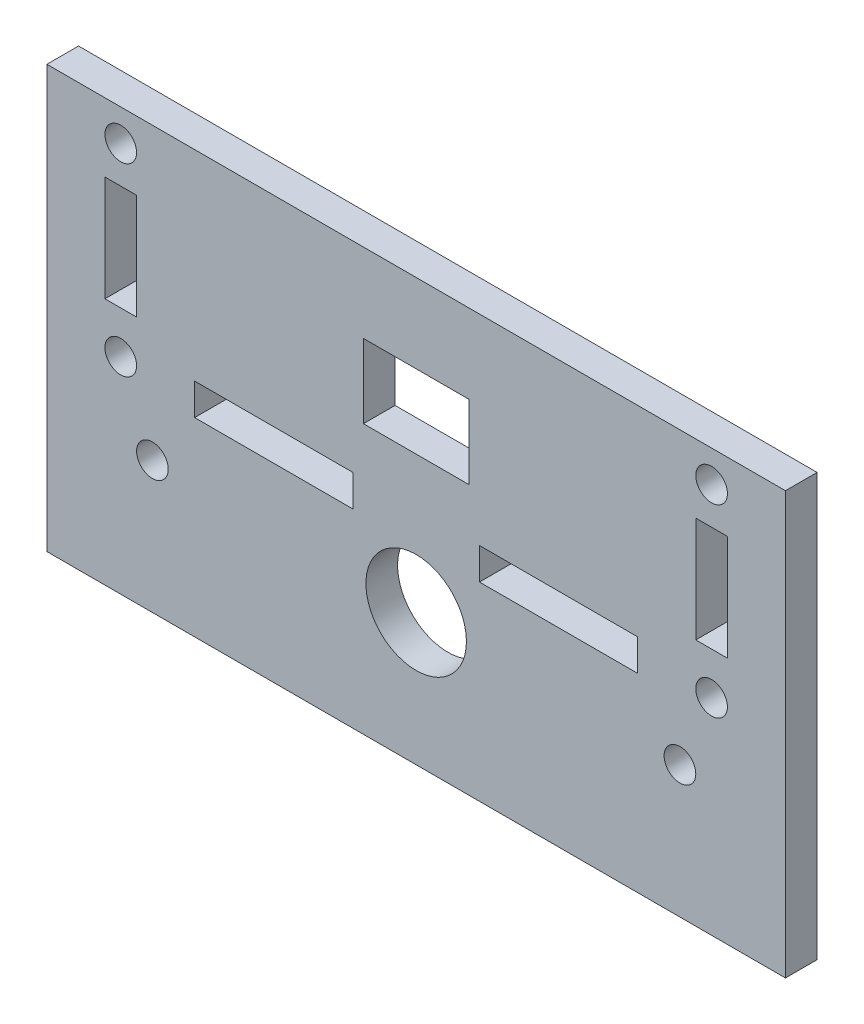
SolidWorks part; units mm, degrees
ref_plane "Front Plane" through (0, 0, 0) normal (0, 0, 1) x (1, 0, 0)
ref_plane "Top Plane" through (0, 0, 0) normal (0, 1, 0) x (1, 0, 0)
ref_plane "Right Plane" through (0, 0, 0) normal (1, 0, 0) x (0, 0, -1)
sketch "Sketch1" plane through (0, 0, 0) normal (0, 0, 1) x (1, 0, 0)
  line L1 (-35, -12.5) -> (35, -12.5)
  line L2 (-35, -12.5) -> (-35, 12.5)
  line L3 (-35, 12.5) -> (35, 12.5)
  line L4 (35, -12.5) -> (35, 12.5)
  line L5 (-35, -12.5) -> (35, 12.5) construction
  line L6 (-35, 12.5) -> (35, -12.5) construction
  line L7 (-35, 12.5) -> (35, 12.5)
  line L8 (-35, 12.5) -> (-35, 27.5)
  line L9 (-35, 27.5) -> (35, 27.5)
  line L10 (35, 12.5) -> (35, 27.5)
  line L11 (-5, 20) -> (5, 20)
  line L12 (-5, 20) -> (-5, 13)
  line L13 (-5, 13) -> (5, 13)
  line L14 (5, 20) -> (5, 13)
  line L15 (-5, 20) -> (5, 13) construction
  line L16 (-5, 13) -> (5, 20) construction
  circle A0 centre (0, 0) radius 4.7625
  circle A1 centre (-25, 0) radius 1.5
  circle A2 centre (25, 0) radius 1.5
  point P11 (0, 16.5)
  dimension "D1" = 9.525
  dimension "D2" = 3
  dimension "D3" = 3
  dimension "D6" = 25
  dimension "D4" = 25
  dimension "D5" = 70
  dimension "D7" = 25
  dimension "D8" = 15
  dimension "D9" = 10
  dimension "D10" = 7
  dimension "D11" = 20
extrude "Boss-Extrude1" add sketch "Sketch1" along normal blind 3 contours L1 L4 L3 L2 A2 A1 A0 | L3 L10 L9 L8 L11 L14 L13 L12
sketch "Sketch2" plane through (0, 0, 3) normal (0, 0, 1) x (1, 0, 0)
  point P26 (-21, 7)
other "Block1-1"
sketch_block "Block1" parameters "D7"=3, "D13"=3, "D1"=22, "D2"=13.85, "D3"=13.85, "D4"=3, "D5"=15, "D6"=15, "D8"=7, "D9"=7, "D10"=3, "D11"=10, "D12"=4, "D14"=3
extrude "Cut-Extrude1" cut sketch "Sketch2" against normal blind 10
